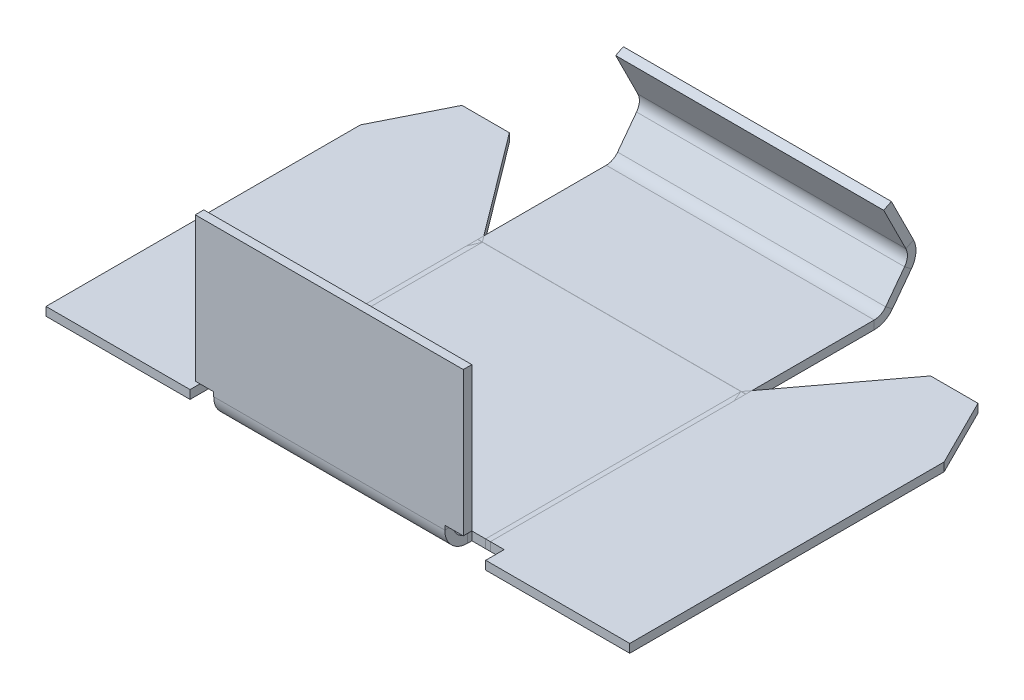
SolidWorks part; units mm, degrees
ref_plane "Vorne" through (0, 0, 0) normal (0, 0, 1) x (1, 0, 0)
ref_plane "Oben" through (0, 0, 0) normal (0, 1, 0) x (1, 0, 0)
ref_plane "Rechts" through (0, 0, 0) normal (1, 0, 0) x (0, 0, -1)
sketch "Skizze1" plane through (0, 0, 0) normal (1, 0, 0) x (0, 0, -1)
  line L0 (0, 0) -> (50, 0)
  line L1 (50, 0) -> (70, 15)
  line L2 (70, 15) -> (70, 25)
  line L3 (60, 30) -> (0, 30)
  line L4 (0, 30) -> (0, 0)
  line L5 (60, 30) -> (70, 25)
  dimension "D1" = 50
  dimension "D2" = 60
  dimension "D3" = 10
  dimension "D4" = 10
  dimension "D5" = 30
  dimension "D6" = 25
extrude "Linear austragen1" add sketch "Skizze1" along normal blind 50
shell "Wandung3" thickness 1.5
rip "Schlitz2"
sheet metal parameters "Blech1" parameters "D1"=2.5, "Dicke"=1.5
bend "Biegung-Winkel6" parameters "D1"=0
flatten bends "Abwickeln1" parameters "D1"=0, "D4"=90, "D5"=1
sketch "Skizze-Winkel1" plane through (0, 1.5, 0) normal (0, 1, 0) x (-1, 0, 0)
  line L0 (-4.75, -1.9187) -> (-45.25, -1.9187) construction
  line L1 (-48.49, -49.5193) -> (-1.51, -49.5193) construction
  line L2 (-48.49, -73.2673) -> (-1.51, -73.2673) construction
  line L3 (-48.49, -81.4908) -> (-1.51, -81.4908) construction
  line L4 (-48.0813, -4.75) -> (-48.0813, -49.4833) construction
  line L5 (-1.9187, -49.4833) -> (-1.9187, -4.75) construction
bend "Biegung-Winkel1" bend angle 90 parameters "D1"=0, "D5"=6
bend "Biegung-Winkel2" bend angle 90 parameters "D1"=0, "D5"=5
bend "Biegung-Winkel3" bend angle 63.435 parameters "D1"=0, "D5"=4
bend "Biegung-Winkel4" bend angle 53.13 parameters "D1"=0, "D5"=3
bend "Biegung-Winkel5" bend angle 36.87 parameters "D1"=0, "D5"=2
process bends "Abbiegen1" parameters "D1"=0
sketch "Abwicklung-Skizze1" plane through (0, 1.5, 0) normal (0, 1, 0) x (-1, 0, 0)
